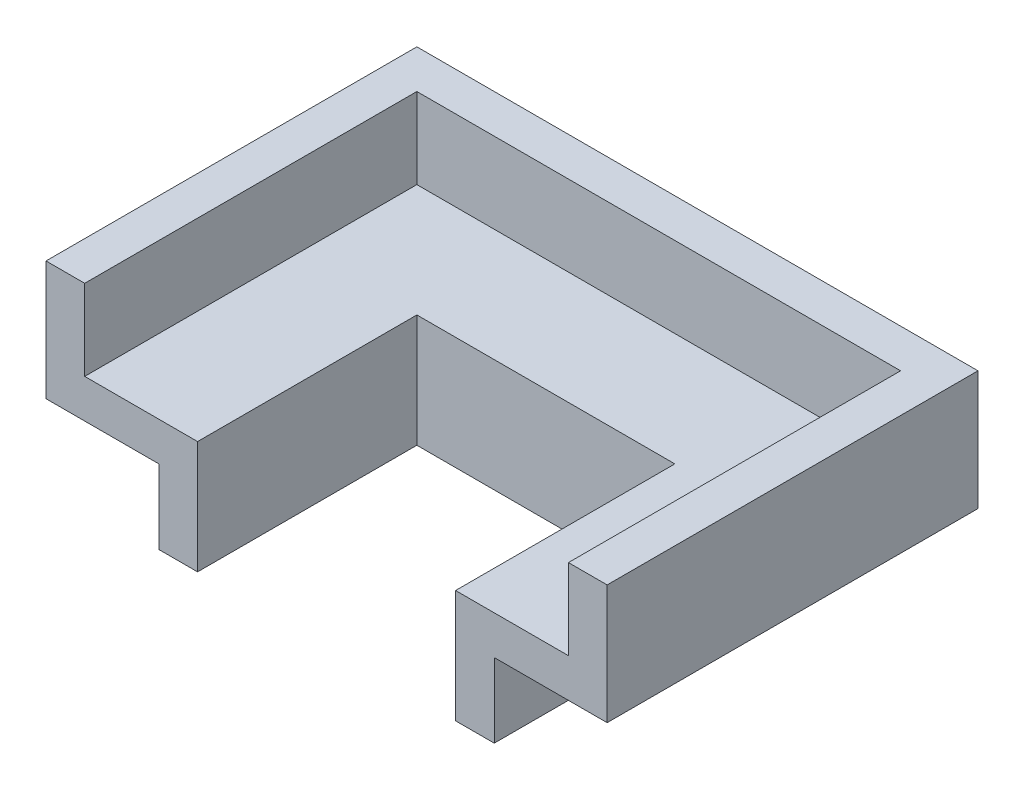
SolidWorks part; units mm, degrees
ref_plane "Front Plane" through (0, 0, 0) normal (0, 0, 1) x (1, 0, 0)
ref_plane "Top Plane" through (0, 0, 0) normal (0, 1, 0) x (1, 0, 0)
ref_plane "Right Plane" through (0, 0, 0) normal (1, 0, 0) x (0, 0, -1)
sketch "Sketch2" plane through (0, 0, 0) normal (0, 1, 0) x (1, 0, 0)
  line L1 (-40, 0) -> (40, 0) construction
  line L2 (-40, 0) -> (-40, 68)
  line L3 (-40, 68) -> (40, 68)
  line L4 (40, 0) -> (40, 68)
  point P5 (0, 0)
  dimension "D1" = 68
  dimension "D2" = 80
sketch "Sketch3" plane through (0, 0, 0) normal (0, 0, 1) x (1, 0, 0)
  line L0 (40, 0) -> (40, 35)
  line L1 (40, 35) -> (75, 35)
  line L2 (75, 35) -> (75, 60)
  line L3 (0, 0) -> (0, 72.1544) construction
  line L4 (52, 0) -> (52, 23)
  line L5 (52, 23) -> (87, 23)
  line L6 (87, 23) -> (87, 60)
  line L7 (40, 0) -> (52, 0)
  line L8 (75, 60) -> (87, 60)
  dimension "D1" = 35
  dimension "D2" = 60
  dimension "D3" = 150
  dimension "D4" = 12
sweep "Sweep1" add profiles "Sketch3" path "Sketch2"
